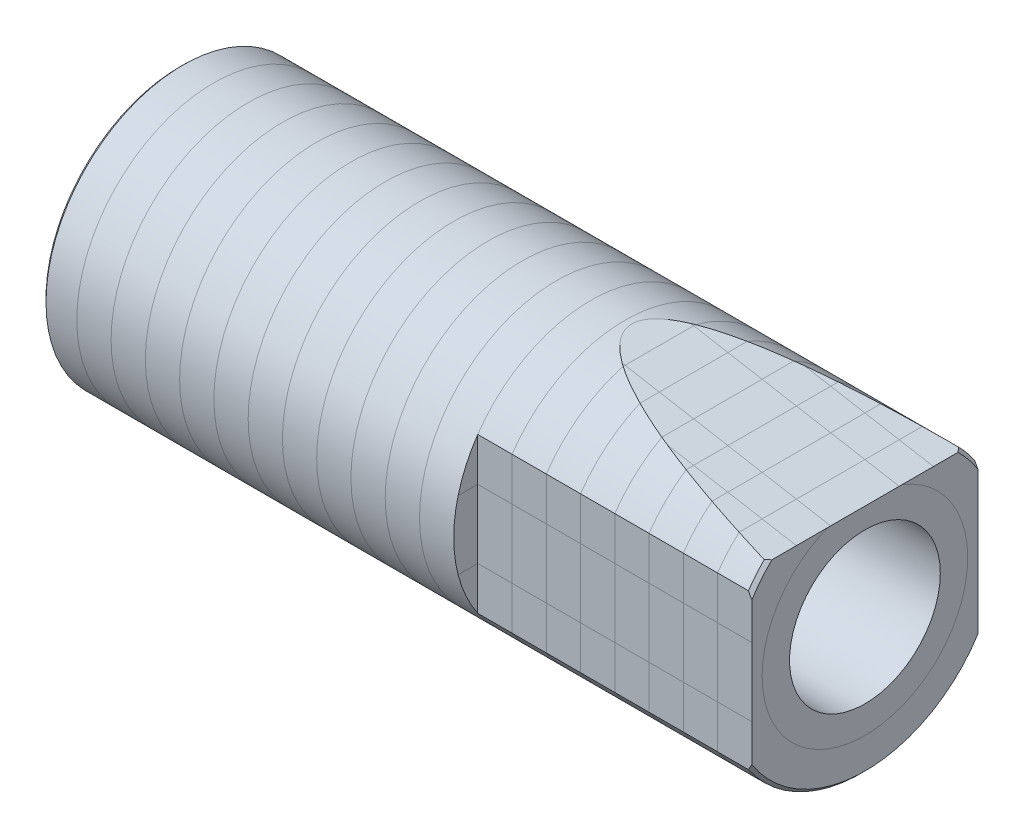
SolidWorks part; units mm, degrees
ref_plane "Front" through (0, 0, 0) normal (0, 0, 1) x (1, 0, 0)
ref_plane "Top" through (0, 0, 0) normal (0, 1, 0) x (1, 0, 0)
ref_plane "Right" through (0, 0, 0) normal (1, 0, 0) x (0, 0, -1)
sketch "Эскиз1" plane through (0, 0, 0) normal (0, 0, 1) x (1, 0, 0)
  line L0 (0, 0) -> (1967.5868, 0) construction
  line L1 (0, 0) -> (0, 2)
  line L2 (0, 2) -> (10, 2)
  line L3 (10, 2) -> (10, 0)
  line L4 (10, 0) -> (0, 0)
  dimension "D1" = 4
  dimension "D2" = 10
revolve "Повернуть1" add sketch "Эскиз1" angle 360 about L0
sketch "Эскиз2" plane through (0, 0, 0) normal (0, 0, 1) x (1, 0, 0)
  line L0 (0, 0) -> (0, 1.85)
  line L1 (0, 2) -> (0, -2) construction
  line L2 (0, 1.85) -> (0.1099, 1.7401)
  line L3 (0.1099, 1.7401) -> (1.115, 1.65)
  line L4 (1.115, 1.65) -> (3, 1.65)
  line L5 (3, 1.65) -> (3.2165, 1.275)
  line L6 (3.2165, 1.275) -> (6.7, 1.275)
  line L7 (6.7, 1.275) -> (7.0031, 0.75)
  line L8 (7.0031, 0.75) -> (7.5, 0.75)
  line L9 (7.5, 0.75) -> (7.5, 1.1)
  line L10 (7.5, 1.1) -> (10, 1.1)
  line L11 (10, -2) -> (10, 2) construction
  line L12 (0, 0) -> (-50000, 0) construction
  line L13 (0, 0) -> (10, 0)
  line L14 (10, 0) -> (10, 1.1)
  line L15 (0.1099, 1.7401) -> (0, 1.75) construction
  dimension "D1" = 45
  dimension "D2" = 3.5
  dimension "D3" = 3.7
  dimension "D4" = 5.125
  dimension "D5" = 3.3
  dimension "D6" = 60
  dimension "D7" = 3
  dimension "D8" = 2.55
  dimension "D9" = 6.7
  dimension "D10" = 60
  dimension "D11" = 1.5
  dimension "D12" = 2.2
  dimension "D13" = 7.5
revolve "Вырез-Повернуть1" cut sketch "Эскиз2" angle 360 about L12
fillet "Скругление1" radius 0.1 1 edges at (7.5, 0, -1.1)
chamfer "Фаска1" [suppressed] distance 0.15 angle 45
chamfer "Фаска2" distance 0.05 angle 45 2 edges at (10, 0, 2) (0, 0, 2)
sketch "Эскиз3" plane through (0, 0, 0) normal (-1, 0, 0) x (0, 0, 1)
  line L1 (-1.4549, 0) -> (-0.7275, -1.26)
  line L2 (-0.7275, -1.26) -> (0.7275, -1.26)
  line L3 (0.7275, -1.26) -> (1.4549, 0)
  line L4 (1.4549, 0) -> (0.7275, 1.26)
  line L5 (0.7275, 1.26) -> (-0.7275, 1.26)
  line L6 (-0.7275, 1.26) -> (-1.4549, 0)
  circle A0 centre (0, 0) radius 1.26 construction
  dimension "D1" = 2.52
extrude "Вырез-Вытянуть1" cut sketch "Эскиз3" against normal blind 5.6
sketch "Эскиз4" plane through (0, 0, 0) normal (0, 0, 1) x (1, 0, 0)
  line L0 (10, -1.95) -> (10, 1.95) construction
  line L1 (10, 1.4) -> (6.5972, 2)
  line L2 (10, 1.4) -> (10, 2)
  line L3 (10, 2) -> (6.5972, 2)
  line L4 (0.05, -2) -> (9.95, -2) construction
  line L5 (9.95, 2) -> (0.05, 2) construction
  line L6 (0, 0) -> (-50000, 0) construction
  dimension "D1" = 3.4
  dimension "D2" = 10
  dimension "D3" = 3.4028
extrude "Вырез-Вытянуть2" cut sketch "Эскиз4" against normal through all both and the other way through all
sketch "Эскиз5" plane through (0, 0, 0) normal (0, 1, 0) x (1, 0, 0)
  line L0 (0, 0) -> (-50000, 0) construction
  line L1 (10, -1.95) -> (10, 1.95) construction
  line L2 (10, -1.65) -> (6, -1.65)
  line L3 (10, -1.65) -> (10, -2)
  line L4 (10, -2) -> (6, -2)
  line L5 (6, -1.65) -> (6, -2)
  line L6 (0.05, -2) -> (9.95, -2) construction
  line L7 (6, 1.65) -> (6, 2)
  line L8 (10, 2) -> (6, 2)
  line L9 (10, 1.65) -> (10, 2)
  line L10 (10, 1.65) -> (6, 1.65)
  line L11 (10, 1.3574) -> (10, -1.3574) construction
  dimension "D1" = 3.3
  dimension "D2" = 4
extrude "Вырез-Вытянуть3" cut sketch "Эскиз5" against normal through all both and the other way through all
ref_plane "Плоскость1" through (0.5, 0, 0) normal (-1, 0, 0) x (0, 0, 1)
ref_plane "Плоскость2" through (1, 0, 0) normal (-1, 0, 0) x (0, 0, 1)
ref_plane "Плоскость3" through (1.5, 0, 0) normal (-1, 0, 0) x (0, 0, 1)
ref_plane "Плоскость4" through (2, 0, 0) normal (-1, 0, 0) x (0, 0, 1)
ref_plane "Плоскость5" through (2.5, 0, 0) normal (-1, 0, 0) x (0, 0, 1)
ref_plane "Плоскость6" through (3, 0, 0) normal (-1, 0, 0) x (0, 0, 1)
ref_plane "Плоскость7" through (3.5, 0, 0) normal (-1, 0, 0) x (0, 0, 1)
ref_plane "Плоскость8" through (4, 0, 0) normal (-1, 0, 0) x (0, 0, 1)
ref_plane "Плоскость9" through (4.5, 0, 0) normal (-1, 0, 0) x (0, 0, 1)
ref_plane "Плоскость10" through (5, 0, 0) normal (-1, 0, 0) x (0, 0, 1)
ref_plane "Плоскость11" through (5.5, 0, 0) normal (-1, 0, 0) x (0, 0, 1)
ref_plane "Плоскость12" through (6, 0, 0) normal (-1, 0, 0) x (0, 0, 1)
ref_plane "Плоскость13" through (6.5, 0, 0) normal (-1, 0, 0) x (0, 0, 1)
ref_plane "Плоскость14" through (7, 0, 0) normal (-1, 0, 0) x (0, 0, 1)
ref_plane "Плоскость15" through (7.5, 0, 0) normal (-1, 0, 0) x (0, 0, 1)
ref_plane "Плоскость16" through (8, 0, 0) normal (-1, 0, 0) x (0, 0, 1)
ref_plane "Плоскость17" through (8.5, 0, 0) normal (-1, 0, 0) x (0, 0, 1)
ref_plane "Плоскость18" through (9, 0, 0) normal (-1, 0, 0) x (0, 0, 1)
ref_plane "Плоскость19" through (9.5, 0, 0) normal (-1, 0, 0) x (0, 0, 1)
ref_plane "Плоскость20" through (0, 0, 0.5) normal (0, 0, 1) x (1, 0, 0)
ref_plane "Плоскость21" through (0, 0, 1) normal (0, 0, 1) x (1, 0, 0)
ref_plane "Плоскость22" through (0, 0, -0.5) normal (0, 0, 1) x (1, 0, 0)
ref_plane "Плоскость23" through (0, 0, -1) normal (0, 0, 1) x (1, 0, 0)
ref_plane "Плоскость24" through (0, 0.5, 0) normal (0, 1, 0) x (1, 0, 0)
ref_plane "Плоскость25" through (0, 1, 0) normal (0, 1, 0) x (1, 0, 0)
ref_plane "Плоскость26" through (0, -0.5, 0) normal (0, 1, 0) x (1, 0, 0)
ref_plane "Плоскость27" through (0, -1, 0) normal (0, 1, 0) x (1, 0, 0)
sketch "Эскиз6" plane through (0, 0, 0) normal (0, 0, 1) x (1, 0, 0)
  point P0 (-1.6028, 0)
sketch "Эскиз7" plane through (10, 0, 0) normal (1, 0, 0) x (0, 0, -1)
  circle A0 centre (0, 0) radius 1.5
  dimension "D1" = 3
